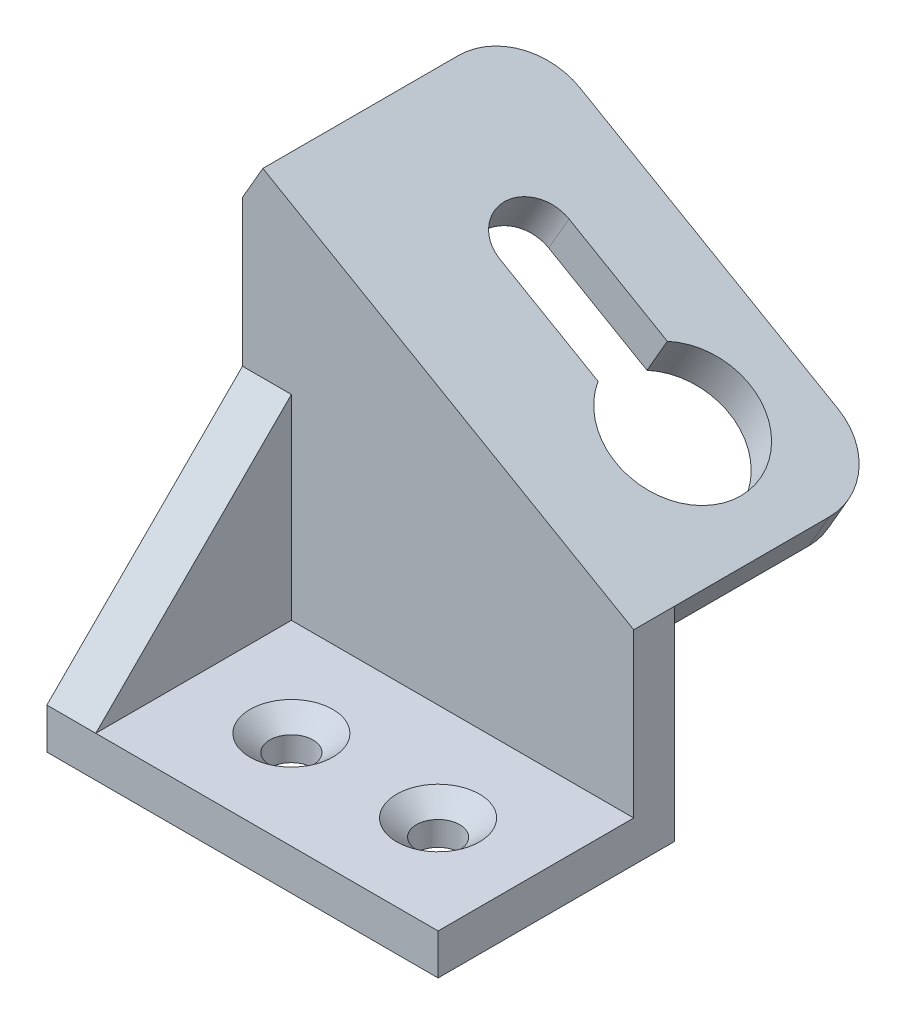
SolidWorks part; units mm, degrees
ref_plane "Front" through (0, 0, 0) normal (0, 0, 1) x (1, 0, 0)
ref_plane "Top" through (0, 0, 0) normal (0, 1, 0) x (1, 0, 0)
ref_plane "Right" through (0, 0, 0) normal (1, 0, 0) x (0, 0, -1)
sketch "Sketch1" plane through (0, 0, 0) normal (1, 0, 0) x (0, 0, -1)
  line L0 (0, 0) -> (0, 31.75)
  line L1 (0, 0) -> (-38.1, 0)
  dimension "D1" = 38.1
  dimension "D2" = 31.75
extrude "Base-Extrude-Thin" add sketch "Sketch1" along normal blind 76.2 thin
ref_plane "Plane5" through (32.7982, 56.8081, 0) normal (0.5, 0.866, 0) x (-0.866, 0.5, 0)
sketch "Sketch2" plane through (0, 31.75, 0) normal (0, 1, 0) x (-1, 0, 0)
  line L4 (0, 0) -> (-76.2, 0)
  line L5 (-76.2, 0) -> (-76.2, -7.9375)
  line L6 (-76.2, -7.9375) -> (0, -7.9375)
  line L7 (0, -7.9375) -> (0, 0)
  line L8 (0, 0) -> (-76.2, 0)
  line L9 (-76.2, 0) -> (-76.2, -7.9375)
  line L10 (-76.2, -7.9375) -> (0, -7.9375)
  line L11 (0, -7.9375) -> (0, 0)
  dimension "D1" = 0
extrude "Boss-Extrude1" add sketch "Sketch2" along normal up to surface
sketch "Sketch3" plane through (32.7982, 56.8081, 0) normal (0.5, 0.866, 0) x (-0.866, 0.5, 0)
  line L0 (37.872, -7.9375) -> (37.872, 0) construction
  line L1 (37.872, 0) -> (-50.1161, 0) construction
  line L2 (-50.1161, 0) -> (-50.1161, -7.9375) construction
  line L3 (37.872, -50.8) -> (37.872, 0)
  line L4 (37.872, 0) -> (-50.1161, 0)
  line L5 (-50.1161, 0) -> (-50.1161, -50.8)
  line L6 (37.872, -50.8) -> (-50.1161, -50.8)
  dimension "D1" = 50.8
extrude "Boss-Extrude2" add sketch "Sketch3" against normal blind 7.9375
sketch "Sketch4" plane through (0, 0, 0) normal (0, 0, 1) x (1, 0, 0)
  line L1 (0, 66.5787) -> (3.9687, 73.4527)
  line L3 (0, 75.7441) -> (76.2, 31.75) construction
extrude "Cut-Extrude1" cut sketch "Sketch4" against normal through all
fillet "Fillet1" radius 12.7 2 edges at (74.2156, 28.313, -50.8) (1.9844, 70.0157, -50.8)
sketch "Sketch5" plane through (0, 0, 0) normal (-1, 0, 0) x (0, 0, 1)
  line L0 (0, 66.5787) -> (0, 0) construction
  line L1 (0, 0) -> (38.1, 0) construction
  line L2 (0, 38.1) -> (0, 0)
  line L3 (0, 0) -> (38.1, 0)
  line L4 (38.1, 0) -> (0, 38.1)
  dimension "D1" = 38.1
extrude "Boss-Extrude3" add sketch "Sketch5" against normal blind 9.525
sketch "Sketch6" plane through (32.7982, 56.8081, 0) normal (0.5, 0.866, 0) x (-0.866, 0.5, 0)
  line L0 (33.2893, -28.575) -> (-28.1191, -28.575) construction
  line L1 (33.2893, 0) -> (-50.1161, 0) construction
  line L2 (5.2184, -35.3219) -> (-16.8938, -35.3219)
  line L3 (5.2184, -21.8281) -> (-16.8938, -21.8281)
  line L4 (-50.1161, -7.9375) -> (-50.1161, -38.1) construction
  line L5 (33.2893, 0) -> (33.2893, -38.1) construction
  arc A0 (5.2184, -21.8281) -> (5.2184, -35.3219) centre (5.2184, -28.575) cw
  arc A1 (-16.8938, -35.3219) -> (-16.8938, -21.8281) centre (-28.1191, -28.575) cw
  dimension "D2" = 33.3375
  dimension "D3" = 13.0969
  dimension "D1" = 28.575
  dimension "D4" = 13.4937
  dimension "D5" = 21.997
extrude "Cut-Extrude2" cut sketch "Sketch6" against normal through all
hole_wizard "CSK for 5/16 Flat Head Machine Screw (100)1" positions "Sketch8" profile "Sketch7" countersink size "5/16" standard "Ansi Inch"
sketch "Sketch8" plane through (0, 0, 0) normal (0, 1, 0) x (-1, 0, 0)
  line L0 (-76.2, 0) -> (-76.2, 38.1) construction
  line L1 (-76.2, 38.1) -> (-9.525, 38.1) construction
  point P0 (-57.15, 19.05)
  dimension "D1" = 19.05
  dimension "D2" = 19.05
sketch "Sketch7" plane through (57.15, 0, 19.05) normal (1, 0, 0) x (0, 0, 1)
  line L0 (0, 0) -> (0, 7.9375)
  line L1 (0, 7.9375) -> (4.2164, 7.9375)
  line L2 (4.2164, 7.9375) -> (4.2164, 3.2289)
  line L3 (4.2164, 3.2289) -> (8.0645, 0)
  line L5 (8.0645, 0) -> (0, 0)
  line L6 (-4.2164, 3.2289) -> (-8.0645, 0) construction
  line L11 (0, -6.35) -> (0, 107.95) construction
  dimension "Thru Hole Dia." = 8.4328
  dimension "Thru Hole Depth" = 7.9375
  dimension "Near C'Sink Dia." = 16.129
  dimension "Near C'Sink Angle" = 100
pattern_linear "LPattern1" count 2 spacing 28.575 along (-1, 0, 0) of "CSK for 5/16 Flat Head Machine Screw (100)1"
